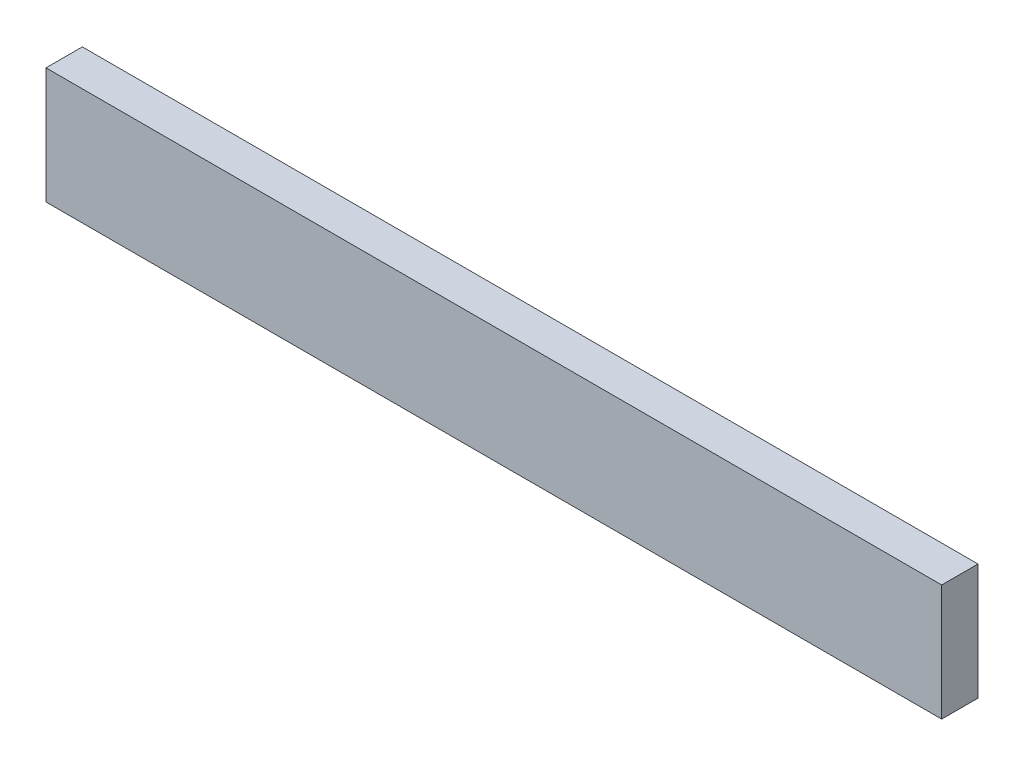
SolidWorks part; units mm, degrees
ref_plane "前视基准面" through (0, 0, 0) normal (0, 0, 1) x (1, 0, 0)
ref_plane "上视基准面" through (0, 0, 0) normal (0, 1, 0) x (1, 0, 0)
ref_plane "右视基准面" through (0, 0, 0) normal (1, 0, 0) x (0, 0, -1)
sketch "草图1" plane through (0, 0, 0) normal (0, 0, 1) x (1, 0, 0)
  line L1 (0, 0) -> (370, 0)
  line L2 (0, 0) -> (0, 48)
  line L3 (0, 48) -> (370, 48)
  line L4 (370, 0) -> (370, 48)
  dimension "D1" = 48
  dimension "D2" = 370
extrude "拉伸1" add sketch "草图1" along normal blind 15
